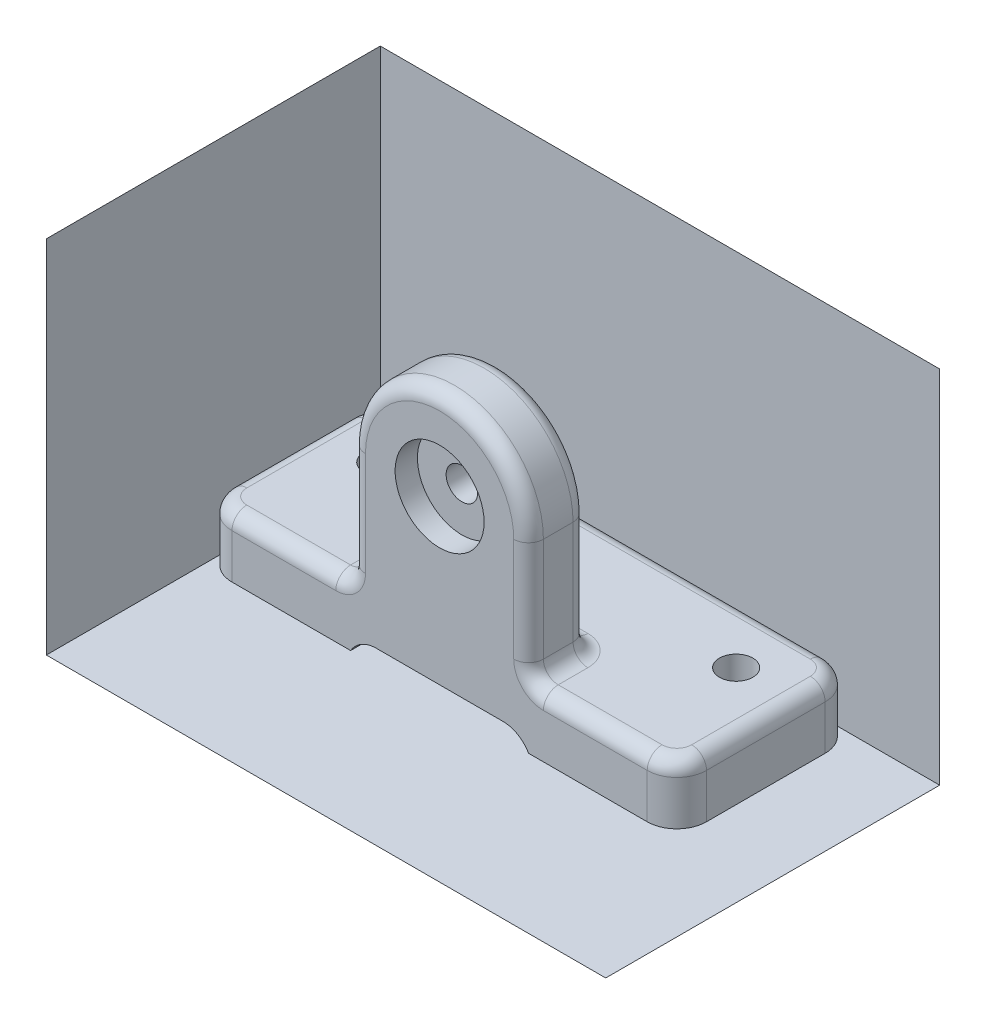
SolidWorks part; units mm, degrees
ref_plane "Plane1" through (0, 0, 0) normal (0, 0, 1) x (1, 0, 0)
ref_plane "Plane2" through (0, 0, 0) normal (0, 1, 0) x (1, 0, 0)
ref_plane "Plane3" through (0, 0, 0) normal (1, 0, 0) x (0, 0, -1)
sketch "Sketch1" plane through (0, 0, 0) normal (0, 1, 0) x (1, 0, 0)
  line L1 (0, 0) -> (101.6, 0)
  line L2 (0, 0) -> (0, 38.1)
  line L3 (0, 38.1) -> (101.6, 38.1)
  line L4 (101.6, 0) -> (101.6, 38.1)
  dimension "D1" = 101.6
  dimension "D2" = 38.1
extrude "Base-Extrude" add sketch "Sketch1" along normal blind 12.7
sketch "Sketch2" plane through (0, 0, 0) normal (0, 0, 1) x (1, 0, 0)
  line L0 (50.8, 0) -> (50.8, 66.8931) construction
  line L1 (0, 0) -> (101.6, 0) construction
  line L2 (31.75, 0) -> (31.75, 38.1)
  line L3 (69.85, 38.1) -> (69.85, 0)
  line L4 (69.85, 0) -> (31.75, 0)
  arc A0 (31.75, 38.1) -> (69.85, 38.1) centre (50.8, 38.1) cw
  dimension "D1" = 19.05
  dimension "D2" = 38.1
extrude "Boss-Extrude1" add sketch "Sketch2" against normal blind 12.7
hole_wizard "CBORE for 1/4 Hex Head Bolt1" positions "Sketch8" profile "Sketch9" counterbore size "1/4" standard "Ansi Inch"
sketch "Sketch8" plane through (1.1036, -5.641, 0) normal (0, 0, 1) x (1, 0, 0)
  point P0 (49.6964, 43.741)
sketch "Sketch9" plane through (50.8, 38.1, 0) normal (1, 0, 0) x (0, -1, 0)
  line L0 (0, 0) -> (0, 38.1)
  line L1 (0, 38.1) -> (3.3782, 38.1)
  line L3 (3.3782, 38.1) -> (3.3782, 4.7752)
  line L4 (3.3782, 4.7752) -> (9.525, 4.7752)
  line L5 (9.525, 4.7752) -> (9.525, 0)
  line L7 (9.525, 0) -> (0, 0)
  line L11 (0, -6.35) -> (0, 107.95) construction
  dimension "Thru Hole Dia." = 6.7564
  dimension "Thru Hole Depth" = 38.1
  dimension "C'Bore Dia." = 19.05
  dimension "C'Bore Depth" = 4.7752
sketch "Sketch10" plane through (-1.0713, 1.1621, 0) normal (0, 0, 1) x (1, 0, 0)
  line L1 (32.8213, -1.1621) -> (70.9213, -1.1621)
  line L2 (32.8213, -1.1621) -> (32.8213, 2.0129)
  line L3 (32.8213, 2.0129) -> (70.9213, 2.0129)
  line L4 (70.9213, -1.1621) -> (70.9213, 2.0129)
  line L8 (70.9213, 11.5379) -> (70.9213, 36.9379) construction
  line L9 (32.8213, 36.9379) -> (32.8213, 11.5379) construction
  line L11 (1.0713, -1.1621) -> (102.6713, -1.1621) construction
  dimension "D1" = 3.175
extrude "Cut-Extrude1" cut sketch "Sketch10" against normal through all
hole_wizard "9/32 (0.28125) Diameter Hole1" positions "Sketch11" profile "Sketch12" hole size "9/32" standard "Ansi Inch"
sketch "Sketch11" plane through (45.9081, 12.7, 7.8552) normal (0, 1, 0) x (-1, 0, 0)
  line L4 (45.9081, -45.9552) -> (45.9081, -7.8552) construction
  line L6 (-55.6919, -7.8552) -> (-55.6919, -45.9552) construction
  line L7 (-55.6919, -45.9552) -> (45.9081, -45.9552) construction
  point P0 (-42.9919, -33.2552)
  point P1 (33.2081, -33.2552)
  dimension "D1" = 12.7
  dimension "D2" = 12.7
  dimension "D3" = 12.7
sketch "Sketch12" plane through (88.9, 12.7, -25.4) normal (1, 0, 0) x (0, 0, 1)
  line L0 (0, 0) -> (0, 12.7)
  line L1 (0, 12.7) -> (3.5719, 12.7)
  line L2 (3.5719, 12.7) -> (3.5719, 0)
  line L5 (3.5719, 0) -> (0, 0)
  line L11 (0, -6.35) -> (0, 107.95) construction
  dimension "Thru Hole Dia." = 7.1437
  dimension "Thru Hole Depth" = 12.7
fillet "Fillet1" radius 6.35 10 edges at (31.75, 1.5875, -38.1) (31.75, 3.175, -19.05) (69.85, 1.5875, -38.1) (69.85, 3.175, -19.05) (31.75, 1.5875, 0) (69.85, 1.5875, 0) (0, 6.35, -38.1) (101.6, 6.35, -38.1) (101.6, 6.35, 0) (0, 6.35, 0)
fillet "Fillet2" radius 3.175 18 edges at (82.55, 12.7, 0) (31.75, 25.4, -12.7) (69.85, 25.4, -12.7) (31.75, 25.4, 0) (69.85, 25.4, 0) (50.8, 57.15, 0) (31.75, 12.7, -6.35) (50.8, 57.15, -12.7) (69.85, 12.7, -6.35) (50.8, 12.7, -12.7) (19.05, 12.7, 0) (0, 12.7, -19.05) (101.6, 12.7, -19.05) (50.8, 12.7, -38.1) (1.8599, 12.7, -36.2401) (99.7401, 12.7, -36.2401) (99.7401, 12.7, -1.8599) (1.8599, 12.7, -1.8599)
sketch "Sketch5" plane through (0, 0, -38.1) normal (0, 0, -1) x (-1, 0, 0)
  line L0 (0, 0) -> (0, 9.525) construction
  line L1 (0, 77.1809) -> (-119.7743, 77.1809)
  line L2 (0, 77.1809) -> (0, 0)
  line L3 (0, 0) -> (-119.7743, 0)
  line L4 (-119.7743, 77.1809) -> (-119.7743, 0)
  line L5 (-6.35, 0) -> (-31.75, 0) construction
surface "Surface-Plane1" sketch "Sketch5"
sketch "Sketch6" plane through (0, 0, 0) normal (-1, 0, 0) x (0, 0, 1)
  line L1 (33.4079, 77.1809) -> (-38.1, 77.1809)
  line L2 (33.4079, 77.1809) -> (33.4079, 0)
  line L3 (33.4079, 0) -> (-38.1, 0)
  line L4 (-38.1, 77.1809) -> (-38.1, 0)
surface "Surface-Plane2" sketch "Sketch6"
sketch "Sketch7" plane through (0, 0, 0) normal (0, -1, 0) x (1, 0, 0)
  line L1 (0, -38.1) -> (119.7743, -38.1)
  line L2 (0, -38.1) -> (0, 33.4079)
  line L3 (0, 33.4079) -> (119.7743, 33.4079)
  line L4 (119.7743, -38.1) -> (119.7743, 33.4079)
surface "Surface-Plane3" sketch "Sketch7"
